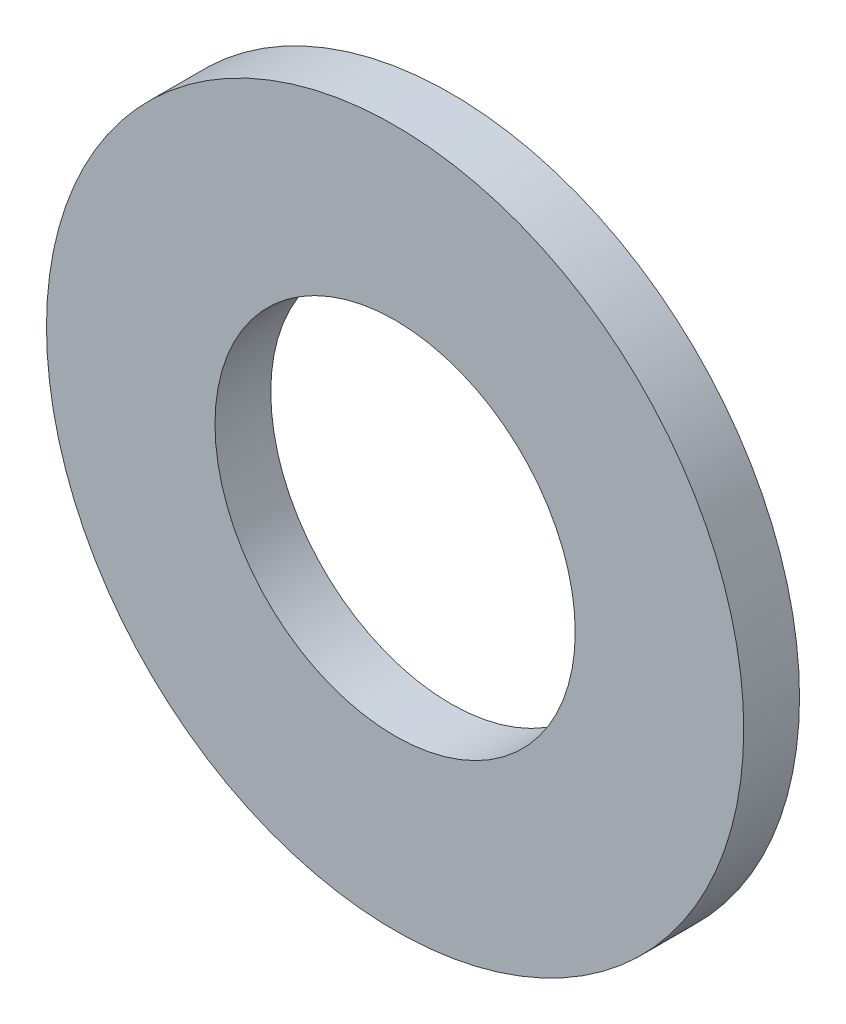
SolidWorks part; units mm, degrees
ref_plane "Front" through (0, 0, 0) normal (0, 0, 1) x (1, 0, 0)
ref_plane "Top" through (0, 0, 0) normal (0, 1, 0) x (1, 0, 0)
ref_plane "Right" through (0, 0, 0) normal (1, 0, 0) x (0, 0, -1)
sketch "Sketch1" plane through (0, 0, 0) normal (0, 0, 1) x (1, 0, 0)
  circle A0 centre (0, 0) radius 4.9213
  circle A1 centre (0, 0) radius 9.525
  dimension "D1" = 9.8425
  dimension "D2" = 19.05
extrude "Extrude1" add sketch "Sketch1" along normal blind 1.524
